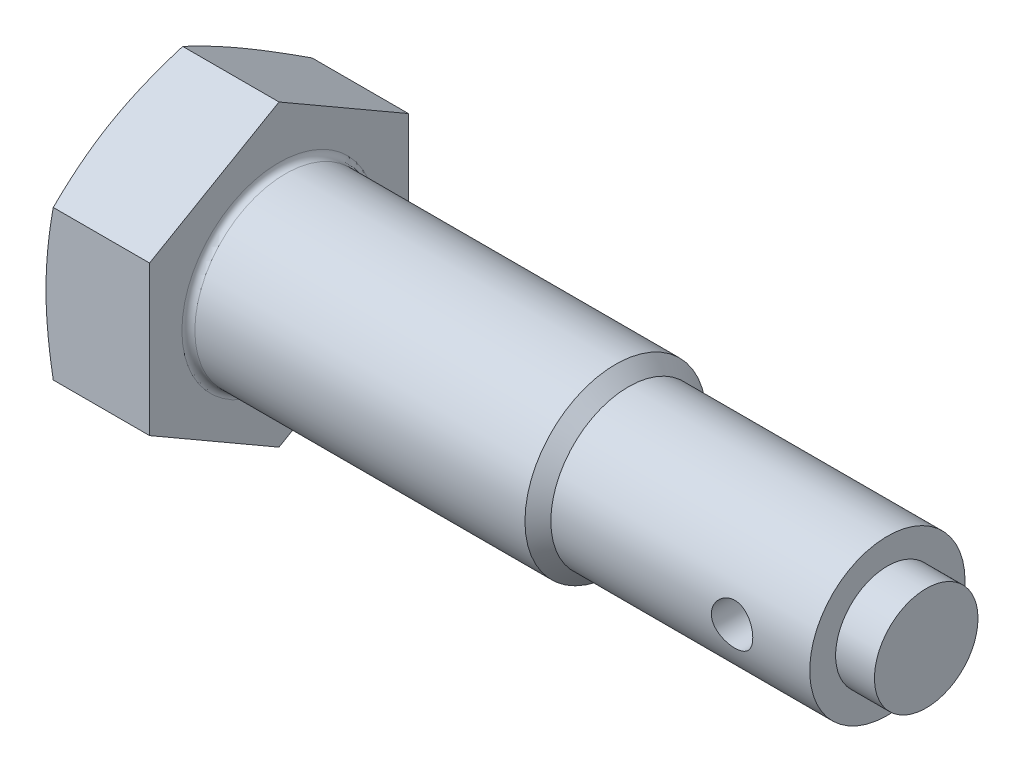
SolidWorks part; units mm, degrees
ref_plane "Front" through (0, 0, 0) normal (0, 0, 1) x (1, 0, 0)
ref_plane "Top" through (0, 0, 0) normal (0, 1, 0) x (1, 0, 0)
ref_plane "Right" through (0, 0, 0) normal (1, 0, 0) x (0, 0, -1)
sketch "Sketch1" plane through (0, 0, 0) normal (1, 0, 0) x (0, 0, -1)
  line L1 (0, -5.7735) -> (5, -2.8868)
  line L2 (5, -2.8868) -> (5, 2.8868)
  line L3 (5, 2.8868) -> (0, 5.7735)
  line L4 (0, 5.7735) -> (-5, 2.8868)
  line L5 (-5, 2.8868) -> (-5, -2.8868)
  line L6 (-5, -2.8868) -> (0, -5.7735)
  circle A0 centre (0, 0) radius 5 construction
  dimension "s" = 10
extrude "BaseHead" add sketch "Sketch1" along normal blind 4
sketch "Sketch2" plane through (4, 0, 0) normal (1, 0, 0) x (0, 0, -1)
  circle A0 centre (0, 0) radius 3.5
  dimension "ds" = 7
extrude "Basebody1" add sketch "Sketch2" along normal blind 13
sketch "Sketch4" plane through (17, 0, 0) normal (1, 0, 0) x (0, 0, -1)
  circle A0 centre (0, 0) radius 3
  dimension "d" = 6
extrude "Basebody2" add sketch "Sketch4" along normal offset from surface (12 mm away) 25
sketch "Sketch5" plane through (29, 0, 0) normal (1, 0, 0) x (0, 0, -1)
  circle A0 centre (0, 0) radius 2
  dimension "dp" = 4
extrude "Cut-Extrude1" cut sketch "Sketch5" against normal blind 1.5 flip side to cut
sketch "Sketch6" plane through (0, 0, 0) normal (0, 0, 1) x (1, 0, 0)
  line L0 (0, 5.7735) -> (0.2815, 5.7735)
  line L1 (0.2815, 5.7735) -> (0, 5)
  line L3 (0, 5) -> (0, 5.7735)
  line L4 (-1.5773, 0) -> (3.1205, 0) construction
  line L6 (4, 5.7735) -> (0, 5.7735) construction
  dimension "D1" = 20
  dimension "D2" = 10
revolve "HeadChamfer" cut sketch "Sketch6" angle 360 about L4
fillet "HeadFillet" radius 0.25 1 edges at (4, 0, 3.5)
chamfer "Chamfer1" distance 0.5 angle 45 1 edges at (17, 0, -3)
sketch "Sketch7" plane through (0, 0, 0) normal (0, 0, 1) x (1, 0, 0)
  line L1 (4, 5.7735) -> (4, 2.8868) construction
  line L4 (27.5, 0) -> (17.5, 0) construction
  circle A0 centre (24.5, 0) radius 0.8
  dimension "d1" = 1.6
  dimension "lh" = 20.5
extrude "Hole" cut sketch "Sketch7" against normal through all and the other way through all
sketch "Sketch8" plane through (0, 0, 0) normal (0, 0, 1) x (1, 0, 0)
  line L0 (27.125, 3.2) -> (27.875, 3.2)
  line L1 (27.875, 3.2) -> (27.875, 3)
  line L2 (27.875, 3) -> (27.5, 2.3505)
  line L3 (27.125, 3) -> (27.5, 2.3505)
  line L4 (27.125, 3.2) -> (27.125, 3)
  line L5 (27.4981, 0) -> (0, 0) construction
  line L6 (27.125, 3) -> (27.875, 3) construction
  line L7 (27.5, 3) -> (27.5, 2.3505) construction
  line L8 (27.5, -3) -> (27.5, 3) construction
  line L9 (27.5, 3) -> (17.5, 3) construction
  point P5 (27.5, 3.2)
  dimension "D1" = 0.2
  dimension "D2" = 0.75
revolve "Cut-Revolve10" [suppressed] cut sketch "Sketch8" angle 360 about L5
pattern_linear "LPattern10" [suppressed] count 12 spacing 0.9 along (1, 0, 0)
equation "\"D1@Chamfer1\" =  ( \"ds@Sketch2\" - \"d@Sketch4\" )  / 2"
equation "\"D2@Sketch6\" = \"s@Sketch1\""
equation "\"D2@Sketch8\" =  ( \"d@Sketch4\" - \"dn@ThreadCosmetic1\" )  / 2"
equation "\"D3@LPattern10\" = \"D2@Sketch8\" * 1.2"
equation "\"D1@LPattern10\" = (  \"l@Basebody2\"  - \"l3@Basebody1\" -\"l2@Cut-Extrude1\" )  / \"D3@LPattern10\""
